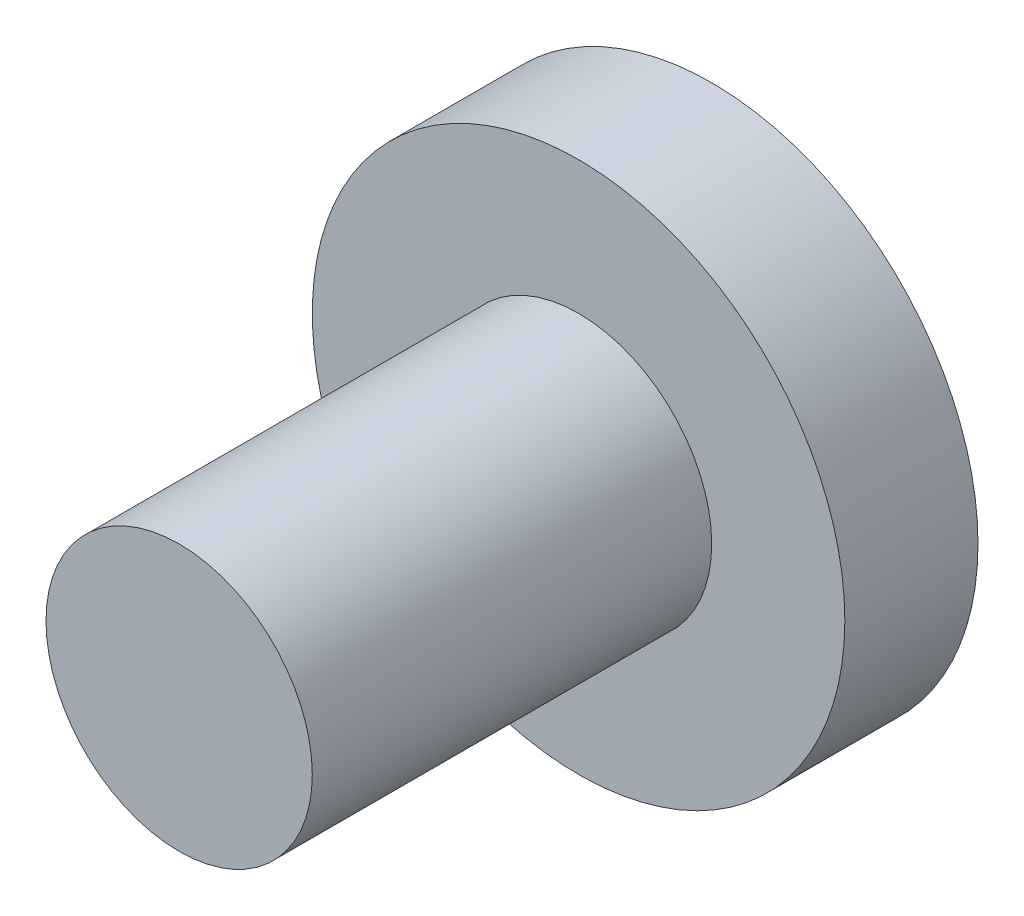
SolidWorks part; units mm, degrees
ref_plane "Face" through (0, 0, 0) normal (0, 0, 1) x (1, 0, 0)
ref_plane "Dessus" through (0, 0, 0) normal (0, 1, 0) x (1, 0, 0)
ref_plane "Droite" through (0, 0, 0) normal (1, 0, 0) x (0, 0, -1)
sketch "Esquisse1" plane through (0, 0, 0) normal (0, 0, 1) x (1, 0, 0)
  circle A0 centre (0, 0) radius 10
extrude "Base-Extrusion" add sketch "Esquisse1" along normal blind 20
sketch "Esquisse2" plane through (0, 0, 20) normal (0, 0, 1) x (1, 0, 0)
  circle A0 centre (0, 0) radius 5
  arc A1 (-0.6348, 4.9595) -> (3.2048, 3.8379) centre (0, 0) ccw construction
extrude "Enlèv. mat.-Extru.1" cut sketch "Esquisse2" against normal blind 15 flip side to cut
